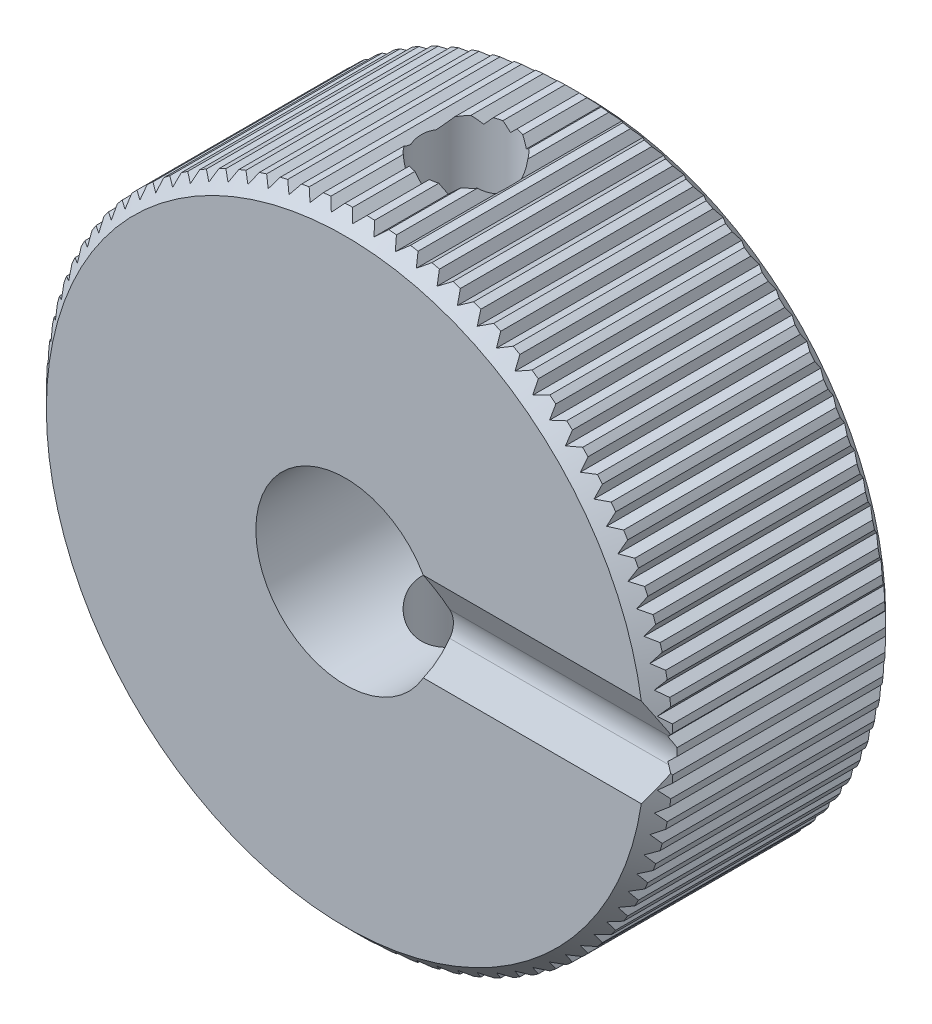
SolidWorks part; units mm, degrees
ref_plane "Front Plane" through (0, 0, 0) normal (0, 0, 1) x (1, 0, 0)
ref_plane "Top Plane" through (0, 0, 0) normal (0, 1, 0) x (1, 0, 0)
ref_plane "Right Plane" through (0, 0, 0) normal (1, 0, 0) x (0, 0, -1)
sketch "Sketch1" plane through (0, 0, 0) normal (0, 0, 1) x (1, 0, 0)
  circle A0 centre (0, 0) radius 1.5875
  circle A1 centre (0, 0) radius 5.5499
  dimension "D1" = 3.175
  dimension "D2" = 11.0998
extrude "Boss-Extrude1" add sketch "Sketch1" along normal mid plane 4.2672
chamfer "Chamfer1" distance 0.254 angle 45 2 edges at (5.5499, 0, -2.1336) (5.5499, 0, 2.1336)
sketch "Sketch4" plane through (0, 0, 0) normal (0, 0, 1) x (1, 0, 0)
  line L0 (0, 0) -> (0, 5.5499) construction
  line L1 (0.127, 5.5499) -> (-0.127, 5.5499)
  line L2 (-0.127, 5.5499) -> (0, 5.4229)
  line L3 (0.127, 5.5499) -> (0, 5.4229)
  circle A0 centre (0, 0) radius 5.5499 construction
  dimension "D1" = 90
  dimension "D2" = 0.254
extrude "Cut-Extrude3" cut sketch "Sketch4" against normal through all both and the other way through all
sketch "Sketch2" plane through (0, 0, 0) normal (0, 1, 0) x (1, 0, 0)
  circle A0 centre (0, 0) radius 0.7874
  dimension "D1" = 1.5748
extrude "Cut-Extrude1" cut sketch "Sketch2" against normal through all both and the other way through all
sketch "Sketch3" plane through (0, 0, 0) normal (1, 0, 0) x (0, 0, -1)
  line L0 (0, 0) -> (-2.1336, 0) construction
  line L1 (-2.1336, 5.2959) -> (-2.1336, -5.2959) construction
  line L2 (-2.1336, 0.7874) -> (-1.8603, 0.2206)
  line L3 (-2.1336, -0.7874) -> (-1.8603, -0.2206)
  line L4 (-2.1336, 0.7874) -> (-2.1336, -0.7874)
  arc A0 (-1.8603, 0.2206) -> (-1.8603, -0.2206) centre (-2.3179, 0) cw
  point P10 (-1.754, 0)
  dimension "D1" = 0.508
  dimension "D2" = 1.5748
extrude "Cut-Extrude2" cut sketch "Sketch3" along normal up to surface (5.5455 mm away)
pattern_circular "CirPattern1" count 90 over 360 about axis through (0, 0, 0) along (0, 0, 1) of "Cut-Extrude3"
